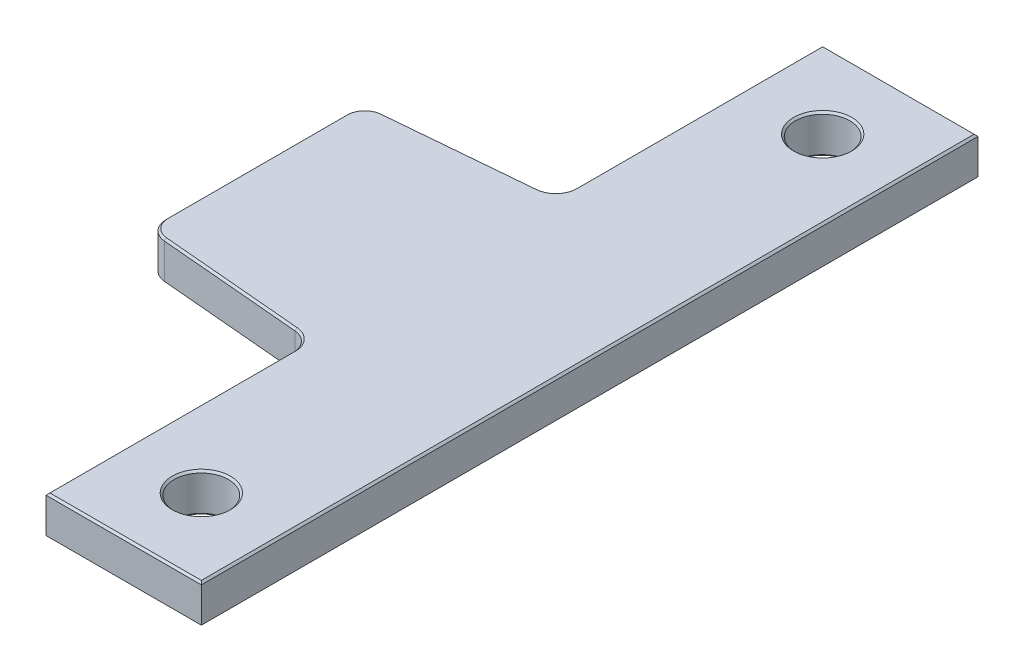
SolidWorks part; units mm, degrees
ref_plane "Plan de face" through (0, 0, 0) normal (0, 0, 1) x (1, 0, 0)
ref_plane "Plan de dessus" through (0, 0, 0) normal (0, 1, 0) x (1, 0, 0)
ref_plane "Plan de droite" through (0, 0, 0) normal (1, 0, 0) x (0, 0, -1)
sketch "Esquisse1" plane through (0, 0, 0) normal (0, 1, 0) x (1, 0, 0)
  line L1 (0, 100) -> (-90, 100)
  line L2 (0, 100) -> (0, -100)
  line L3 (0, -100) -> (-90, -100)
  line L4 (-90, 100) -> (-90, -100)
  dimension "D1" = 200
  dimension "D2" = 90
extrude "Boss.-Extru.1" add sketch "Esquisse1" along normal blind 10
hole_wizard "Diamètre du perçage Ø14.0 (14)1" positions "Esquisse3" profile "Esquisse2" hole size "Ø14.0" standard "ISO"
sketch "Esquisse3" plane through (0, 10, 0) normal (0, 1, 0) x (-1, 0, 0)
  line L0 (20, 80) -> (20, -80) construction
  line L1 (0, 0) -> (20, 0) construction
  line L2 (0, 100) -> (0, -100) construction
  point P0 (20, 80)
  point P1 (20, -80)
  dimension "D1" = 160
  dimension "D2" = 20
sketch "Esquisse2" plane through (-20, 10, 80) normal (1, 0, 0) x (0, 0, 1)
  line L0 (0, 0) -> (0, 10)
  line L1 (0, 10) -> (7, 10)
  line L2 (7, 10) -> (7, 0)
  line L5 (7, 0) -> (0, 0)
  line L11 (0, -6.35) -> (0, 107.95) construction
  dimension "Diamètre du perçage jusqu'au prochain" = 14
  dimension "Profondeur du perçage jusqu'au prochain" = 10
sketch "Esquisse4" plane through (0, 10, 0) normal (0, 1, 0) x (1, 0, 0)
  line L0 (-40, -100) -> (-40, -31.7)
  line L1 (-90, -100) -> (0, -100) construction
  line L2 (-40, -31.7) -> (-86, -27.6772)
  line L3 (-86, -27.6772) -> (-86, 27.6772)
  line L4 (-86, 27.6772) -> (-40, 31.7)
  line L5 (-40, 31.7) -> (-40, 100)
  line L6 (0, 100) -> (-90, 100) construction
  line L7 (0, 0) -> (-86, 0) construction
  line L8 (-40, -31.7) -> (-40, 0) construction
  line L9 (-40, 0) -> (-40, 31.7) construction
  line L10 (-90, 100) -> (-90, -100) construction
  line L11 (-90, 100) -> (-90, -100)
  line L12 (-40, 100) -> (-90, 100)
  line L13 (-90, -100) -> (-40, -100)
  dimension "D1" = 46
  dimension "D2" = 63.4
  dimension "D3" = 85.002
extrude "Enlèv. mat.-Extru.1" cut sketch "Esquisse4" against normal through all
fillet "Congé1" radius 5 4 edges at (-40, 5, 31.7) (-86, 5, 27.6772) (-86, 5, -27.6772) (-40, 5, -31.7)
chamfer "Chanfrein1" distance 0.5 angle 45 28 edges at (-20, 0, -73) (-20, 0, 87) (-41.3137, 0, 32.9038) (-40, 0, 68.1409) (-20, 0, 100) (0, 0, 0) (-20, 0, -100) (-40, 0, -68.1409) (-41.3137, 0, -32.9038) (-63, 0, -29.6886) (-84.6863, 0, -26.4734) (-86, 0, 0) (-84.6863, 0, 26.4734) (-63, 0, 29.6886) (-84.6863, 10, -26.4734) (-63, 10, -29.6886) (-41.3137, 10, -32.9038) (-40, 10, -68.1409) (-20, 10, -100) (0, 10, 0) (-20, 10, 100) (-40, 10, 68.1409) (-41.3137, 10, 32.9038) (-63, 10, 29.6886) (-84.6863, 10, 26.4734) (-86, 10, 0) (-20, 10, -73) (-20, 10, 87)
